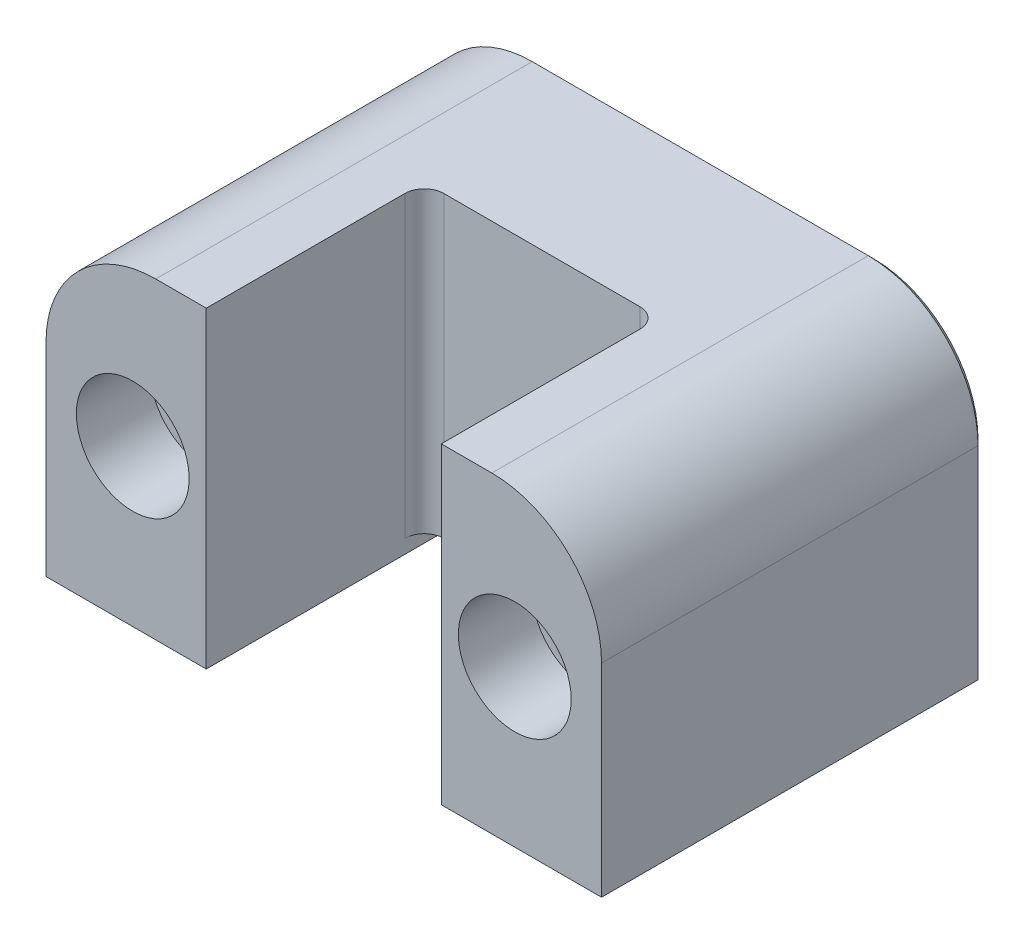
SolidWorks part; units mm, degrees
ref_plane "Front Plane" through (0, 0, 0) normal (0, 0, 1) x (1, 0, 0)
ref_plane "Top Plane" through (0, 0, 0) normal (0, 1, 0) x (1, 0, 0)
ref_plane "Right Plane" through (0, 0, 0) normal (1, 0, 0) x (0, 0, -1)
sketch "Sketch1" plane through (0, 0, 0) normal (0, 1, 0) x (1, 0, 0)
  line L0 (-55, 0) -> (55, 0) construction
  line L1 (-25.3937, 0) -> (-10.7442, 0)
  line L2 (-25.3937, 0) -> (-25.3937, 34.925)
  line L3 (-25.3937, 34.925) -> (25.3936, 34.925)
  line L4 (25.3937, 0) -> (25.3936, 34.925)
  line L5 (0, -55) -> (0, 55) construction
  line L6 (10.7442, 0) -> (25.3937, 0)
  line L8 (-10.7442, 0) -> (-10.7442, 19.939)
  line L9 (-10.7442, 19.939) -> (10.7442, 19.939)
  line L10 (10.7442, 0) -> (10.7442, 19.939)
  dimension "D1" = 50.7873
  dimension "D2" = 34.925
  dimension "D3" = 25.3937
  dimension "D4" = 21.4884
  dimension "D5" = 19.939
  dimension "D6" = 10.7442
extrude "Extrude1" add sketch "Sketch1" along normal blind 28.575
sketch "Sketch3" plane through (0, 0, 0) normal (0, -1, 0) x (1, 0, 0)
  line L0 (10.7442, -19.939) -> (10.7442, 0) construction
  line L1 (-10.7442, -26.543) -> (10.7442, -26.543)
  line L2 (-10.7442, -26.543) -> (-10.7442, -14.7729)
  line L3 (-10.7442, -14.7729) -> (10.7442, -14.7729)
  line L4 (10.7442, -26.543) -> (10.7442, -14.7729)
  line L5 (15.7163, 0) -> (-15.7163, 0) construction
  line L6 (-10.7442, 0) -> (-10.7442, -19.939) construction
  dimension "D1" = 26.543
  dimension "D2" = 11.7701
extrude "Cut-Extrude2" cut sketch "Sketch3" against normal blind 1.27
fillet "Fillet3" radius 2.032 2 edges at (10.7442, 0.635, -26.543) (-10.7442, 0.635, -26.543)
fillet "Fillet4" radius 1.778 2 edges at (10.7442, 14.9225, -19.939) (-10.7442, 14.9225, -19.939)
ref_plane "Plane1" through (0, 14.2875, 0) normal (0, 1, 0) x (-1, 0, 0)
sketch "Sketch4" plane through (0, 14.2875, 0) normal (0, 1, 0) x (-1, 0, 0)
  line L0 (17.4625, -34.925) -> (17.4625, 0)
  line L2 (17.4625, 0) -> (12.3063, 0)
  line L4 (12.3063, 0) -> (12.3063, -6.7564)
  line L5 (12.3063, -6.7564) -> (13.8938, -6.7564)
  line L7 (13.8938, -6.7564) -> (13.8938, -34.925)
  line L8 (13.8938, -34.925) -> (17.4625, -34.925)
  line L9 (17.4625, -4.7498) -> (17.4625, 6.5086) construction
  line L10 (17.4625, 6.5086) -> (17.4625, -40.8278) construction
  line L12 (15.7163, 0) -> (-15.7163, 0) construction
  line L13 (25.3937, 0) -> (10.7442, 0) construction
  line L14 (-25.3936, -34.925) -> (25.3937, -34.925) construction
  line L15 (0, 15.7163) -> (0, -15.7163) construction
  dimension "D1" = 10.3124
  dimension "D2" = 7.1374
  dimension "D3" = 6.7564
  dimension "D4" = 17.4625
revolve "Cut-Revolve9" cut sketch "Sketch4" angle 360 about L9
mirror "Mirror1" about plane through (0, 0, 0) normal (1, 0, 0) of "Cut-Revolve9"
fillet "Fillet5" radius 10.033 2 edges at (25.3936, 28.575, -17.4625) (-25.3937, 28.575, -17.4625)
chamfer "Chamfer1" distance 0.508 angle 45 5 edges at (25.3936, 9.271, -34.925) (-25.3937, 9.271, -34.925) (22.4551, 25.6364, -34.925) (-22.4551, 25.6364, -34.925) (0, 28.575, -34.925)
